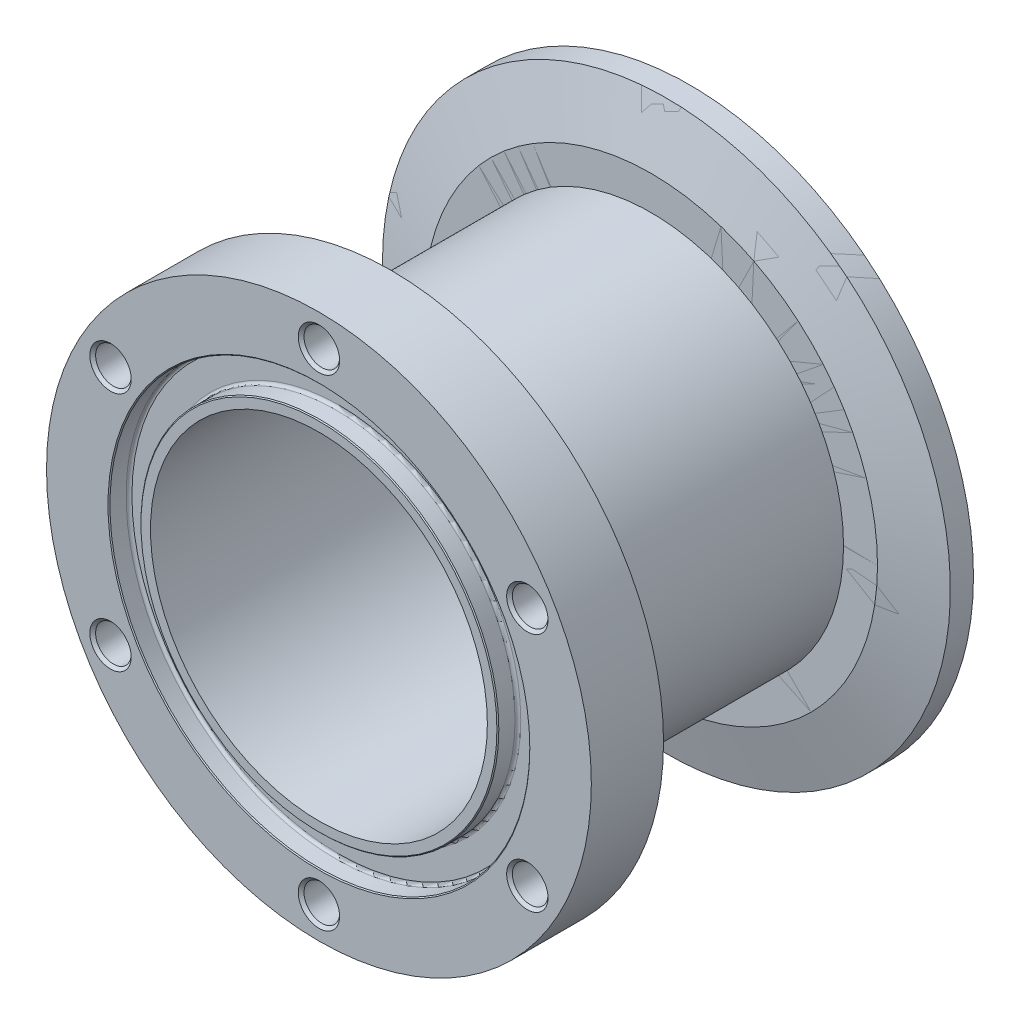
SolidWorks part; units mm, degrees
ref_plane "Front" through (0, 0, 0) normal (0, 0, 1) x (1, 0, 0)
ref_plane "Top" through (0, 0, 0) normal (0, 1, 0) x (1, 0, 0)
ref_plane "Right" through (0, 0, 0) normal (1, 0, 0) x (0, 0, -1)
imported_body "qf50-050-sbb.stp"
sketch "Sketch1" plane through (0, 0, 2.54) normal (0, 0, 1) x (1, 0, 0)
  circle A0 centre (0, 0) radius 22.225
  dimension "D1" = 44.45
extrude "Cut-Extrude1" cut sketch "Sketch1" against normal through all
sketch "Sketch2" plane through (0, 0, -2.54) normal (0, 0, -1) x (-1, 0, 0)
  circle A0 centre (0, 0) radius 23.0505
  circle A1 centre (0, 0) radius 22.225
extrude "Cut-Extrude2" cut sketch "Sketch2" against normal up to surface and the other way through all
sketch "Sketch3" plane through (0, 0, 2.54) normal (0, 0, 1) x (1, 0, 0)
  circle A0 centre (0, 0) radius 25.4
  circle A1 centre (0, 0) radius 22.225
  dimension "D1" = 44.45
  dimension "D2" = 50.8
extrude "Boss-Extrude1" add sketch "Sketch3" along normal blind 34.29
sketch "Sketch4" plane through (0, 0, 36.83) normal (0, 0, 1) x (1, 0, 0)
  circle A0 centre (0, 0) radius 22.225
  circle A1 centre (0, 0) radius 35.941
  dimension "D1" = 71.882
extrude "Boss-Extrude2" add sketch "Sketch4" along normal blind 9.525
sketch "Sketch5" plane through (0, 0, 46.355) normal (0, 0, 1) x (1, 0, 0)
  circle A0 centre (0, 0) radius 31.75 construction
  dimension "D1" = 63.5
hole_wizard "#13 (0.185) Diameter Hole1" positions "Sketch6" profile "Sketch7" hole size "#13" standard "ANSI Inch"
sketch "Sketch6" plane through (0, 0, 46.355) normal (0, 0, 1) x (1, 0, 0)
  circle A0 centre (0, 0) radius 31.75 construction
  point P0 (0, 31.75)
  point P9 (27.4963, 15.875)
  point P10 (27.4963, -15.875)
  point P11 (0, -31.75)
  point P12 (-27.4963, -15.875)
  point P13 (-27.4963, 15.875)
  dimension "D1" = 6
sketch "Sketch7" plane through (0, 31.75, 46.355) normal (1, 0, 0) x (0, -1, 0)
  line L0 (0, 0) -> (0, 25.4)
  line L1 (0, 25.4) -> (2.3495, 23.9883)
  line L2 (2.3495, 23.9883) -> (2.3495, 0.381)
  line L3 (2.3495, 0.381) -> (2.7305, 0)
  line L5 (2.7305, 0) -> (0, 0)
  line L6 (-2.3495, 0.381) -> (-2.7305, 0) construction
  line L10 (0, 25.4) -> (-2.3495, 23.9883) construction
  line L11 (0, -6.35) -> (0, 107.95) construction
  dimension "Hole Dia." = 4.699
  dimension "Hole Depth" = 25.4
  dimension "Near C'Sink Dia." = 5.461
  dimension "Near C'Sink Angle" = 90
  dimension "Drill Angle" = 118
sketch "Sketch8" plane through (0, 0, 46.355) normal (0, 0, 1) x (1, 0, 0)
  circle A0 centre (0, 0) radius 27.6987
  circle A1 centre (0, 0) radius 23.6093
  dimension "D1" = 47.2186
  dimension "D2" = 4.0894
extrude "Cut-Extrude3" cut sketch "Sketch8" against normal blind 2.6416
fillet "Fillet2" radius 0.381 2 edges at (23.6093, 0, 43.7134) (27.6987, 0, 43.7134)
chamfer "Chamfer1" distance 0.127 angle 45 2 edges at (23.6093, 0, 46.355) (27.6987, 0, 46.355)
